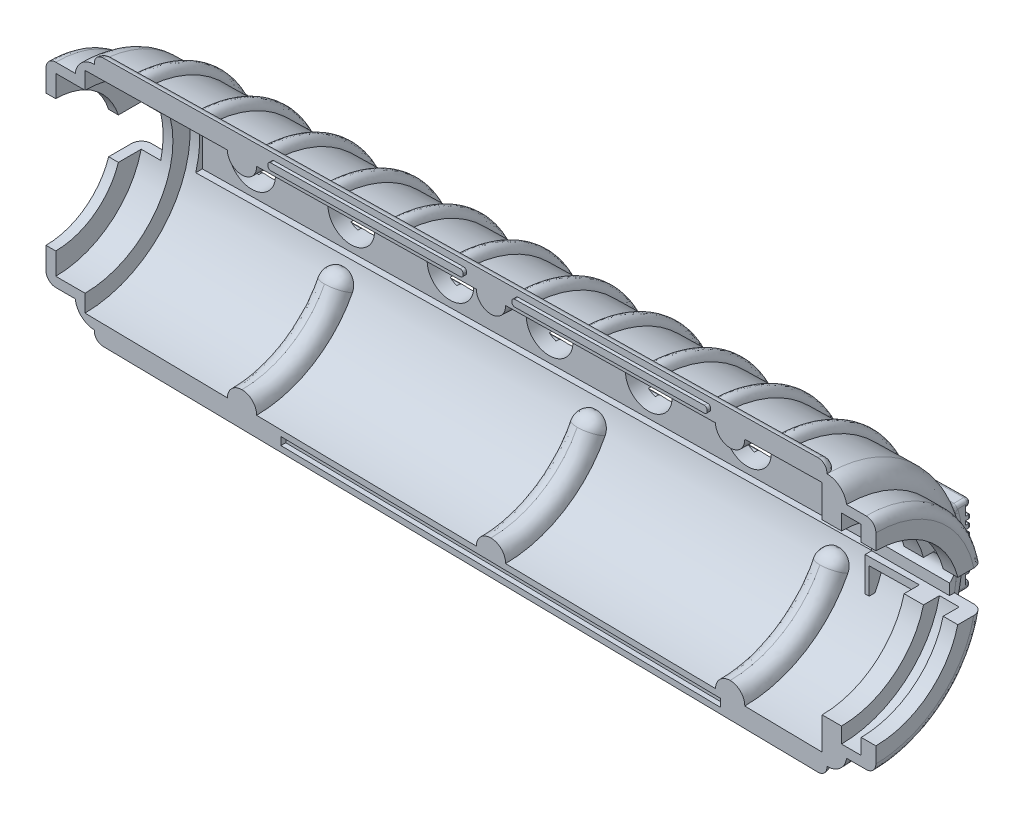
SolidWorks part; units mm, degrees
ref_plane "Front Plane" through (0, 0, 0) normal (0, 0, 1) x (1, 0, 0)
ref_plane "Top Plane" through (0, 0, 0) normal (0, 1, 0) x (1, 0, 0)
ref_plane "Right Plane" through (0, 0, 0) normal (1, 0, 0) x (0, 0, -1)
imported_body "FRONT HAND GAURD"
sketch "Sketch2" plane through (0, 0, 0) normal (0, 1, 0) x (1, 0, 0)
  line L0 (0, 19.9009) -> (-25.4, 19.9009) construction
  line L1 (0, 19.9009) -> (0, 22.1869)
  line L2 (0, 22.1869) -> (-25.4, 22.1869)
  line L3 (-25.4, 22.1869) -> (-25.4, 19.9009)
  line L4 (-25.4, 19.9009) -> (0, 19.9009)
  dimension "D1" = 19.9009
  dimension "D2" = 2.286
  dimension "D3" = 25.4
revolve "Cut-Revolve1" cut sketch "Sketch2" angle 360 about L0
